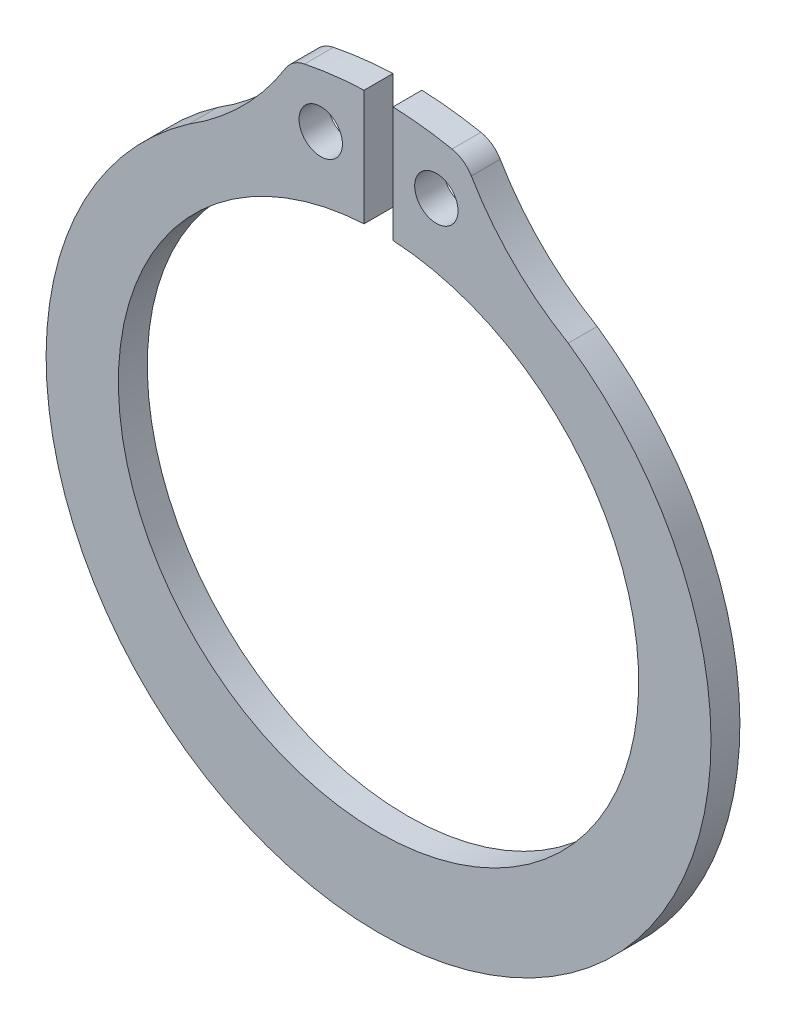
SolidWorks part; units mm, degrees
ref_plane "Face" through (0, 0, 0) normal (0, 0, 1) x (1, 0, 0)
ref_plane "Dessus" through (0, 0, 0) normal (0, 1, 0) x (1, 0, 0)
ref_plane "Droite" through (0, 0, 0) normal (1, 0, 0) x (0, 0, -1)
sketch "Esquisse1" plane through (0, 0, 0) normal (0, 0, 1) x (1, 0, 0)
  circle A0 centre (0, 0) radius 9
  arc A1 (6.562, 8.9441) -> (-6.562, 8.9441) centre (0, -0.5) cw
  arc A2 (-3, 12.6491) -> (3, 12.6491) centre (0, 0) cw
  arc A3 (-3, 12.6491) -> (-6.562, 8.9441) centre (-12.0819, 17.8156) cw
  arc A4 (3, 12.6491) -> (6.562, 8.9441) centre (11.2061, 16.9736) ccw
  point P3 (0, -0.5)
  dimension "D1" = 18
  dimension "D6" = 13
  dimension "D2" = 0.5
  dimension "D4" = 3
  dimension "D5" = 3
extrude "Base-Extrusion" add sketch "Esquisse1" along normal blind 1
sketch "Esquisse2" plane through (0, 0, 1) normal (0, 0, 1) x (1, 0, 0)
  line L1 (-0.5, 14) -> (0.5, 14)
  line L2 (-0.5, 14) -> (-0.5, 8)
  line L3 (-0.5, 8) -> (0.5, 8)
  line L4 (0.5, 14) -> (0.5, 8)
  circle A0 centre (-2, 11) radius 0.75
  circle A1 centre (2, 11) radius 0.75
  dimension "D1" = 1.5
  dimension "D2" = 1.5
  dimension "D3" = 4
  dimension "D4" = 2
  dimension "D5" = 11
  dimension "D6" = 11
  dimension "D7" = 6
  dimension "D8" = 8
  dimension "D9" = 0.5
  dimension "D10" = 0.5
extrude "Enlèv. mat.-Extru.1" cut sketch "Esquisse2" against normal through all
fillet "Congé1" radius 1
